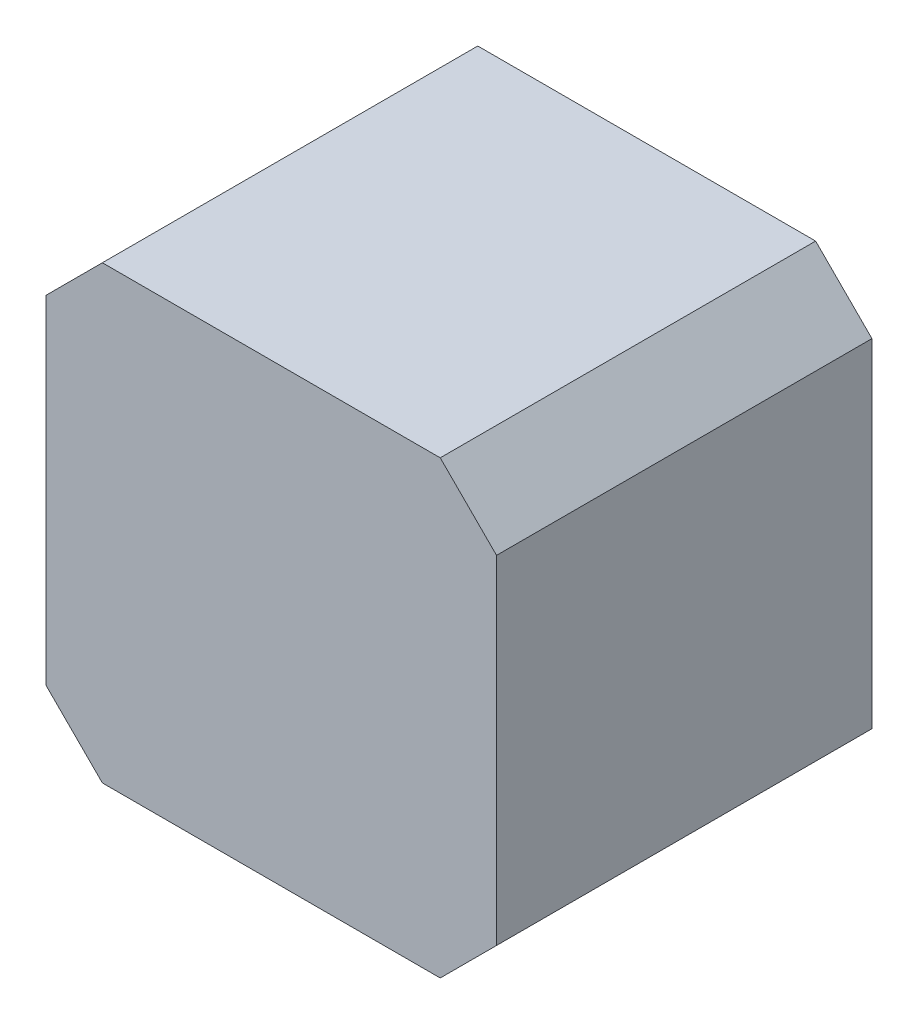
SolidWorks part; units mm, degrees
ref_plane "Front Plane" through (0, 0, 0) normal (0, 0, 1) x (1, 0, 0)
ref_plane "Top Plane" through (0, 0, 0) normal (0, 1, 0) x (1, 0, 0)
ref_plane "Right Plane" through (0, 0, 0) normal (1, 0, 0) x (0, 0, -1)
sketch "Sketch1" plane through (0, 0, 0) normal (0, 0, 1) x (1, 0, 0)
  line L1 (0, 0) -> (-12, 0)
  line L2 (0, 0) -> (0, 12)
  line L3 (0, 12) -> (-12, 12)
  line L4 (-12, 0) -> (-12, 12)
  dimension "D1" = 12
extrude "Extrude1" add sketch "Sketch1" along normal mid plane 10
fillet "Fillet4" [suppressed] radius 3
chamfer "Chamfer1" distance 1.5 angle 45 4 edges at (0, 12, 0) (-12, 12, 0) (-12, 0, 0) (0, 0, 0)
